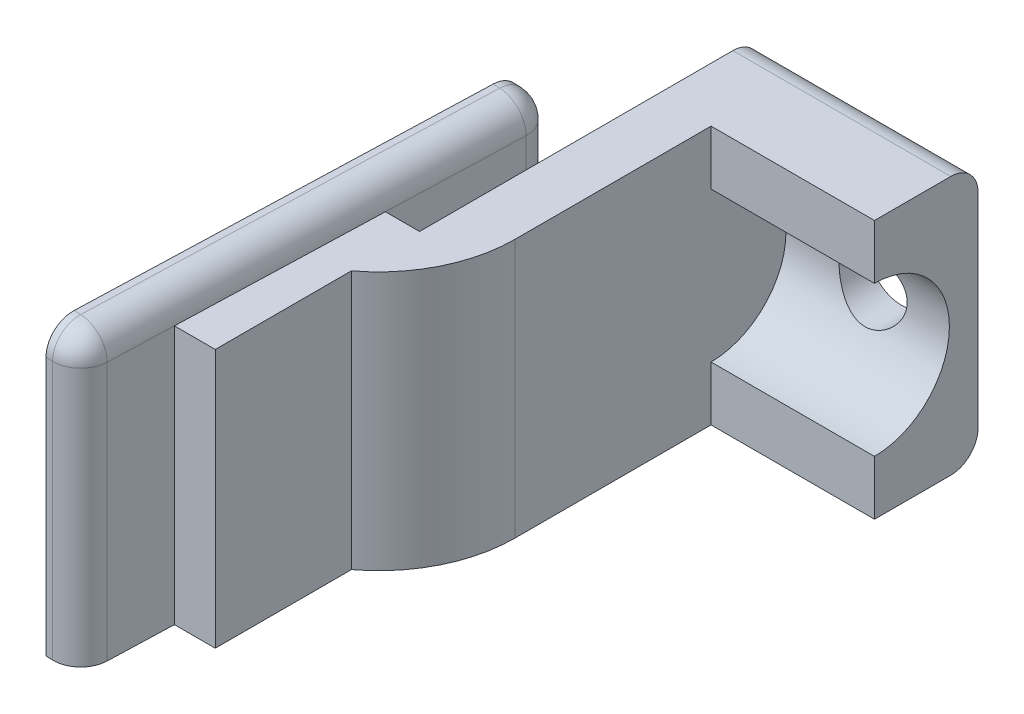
SolidWorks part; units mm, degrees
ref_plane "Front" through (0, 0, 0) normal (0, 0, 1) x (1, 0, 0)
ref_plane "Top" through (0, 0, 0) normal (0, 1, 0) x (1, 0, 0)
ref_plane "Right" through (0, 0, 0) normal (1, 0, 0) x (0, 0, -1)
sketch "Sketch1" plane through (0, 0, 0) normal (0, 1, 0) x (1, 0, 0)
  line L0 (3, 40) -> (3, 15)
  line L1 (0, 0) -> (3, 0)
  line L2 (0, 0) -> (0, 15)
  line L3 (3, 40) -> (7, 40)
  line L4 (7, 10) -> (7, 40)
  line L5 (3, 15) -> (0, 15)
  line L6 (7, 40) -> (0, 40) construction
  line L7 (0, 40) -> (0, 15) construction
  line L8 (3, 10) -> (3, 0)
  line L9 (3, 10) -> (7, 10)
  dimension "D1" = 40
  dimension "D2" = 7
  dimension "D3" = 4
  dimension "D4" = 25
  dimension "D5" = 10
extrude "Boss-Extrude2" add sketch "Sketch1" along normal blind 19
fillet "Fillet1" radius 10 1 edges at (7, 9.5, -10)
sketch "Sketch2" plane through (7, 0, 0) normal (1, 0, 0) x (0, 0, -1)
  line L0 (18, 19) -> (40, 19) construction
  line L1 (40, 0) -> (32.4, 0)
  line L2 (40, 0) -> (40, 19)
  line L3 (40, 19) -> (32.4, 19)
  line L4 (32.4, 0) -> (32.4, 19)
  dimension "D1" = 7.6
extrude "Boss-Extrude3" add sketch "Sketch2" along normal blind 12
sketch "Sketch3" plane through (19, 0, 0) normal (1, 0, 0) x (0, 0, -1)
  line L0 (32.4, 19) -> (32.4, 0) construction
  circle A0 centre (32.4, 9.5) radius 5.5
  dimension "D1" = 11
extrude "Cut-Extrude1" cut sketch "Sketch3" against normal up to surface (12 mm away)
sketch "Sketch4" plane through (0, 0, -40) normal (0, 0, -1) x (-1, 0, 0)
  line L0 (-19, 0) -> (-19, 19) construction
  line L1 (-11, 19) -> (-11, 0) construction
  line L2 (-19, 19) -> (-3, 19) construction
  line L3 (-19, 0) -> (-3, 0) construction
  circle A0 centre (-13.4, 9.5) radius 2.5
  point P10 (0, 0)
  point P11 (-11, 9.5)
  dimension "D1" = 5
  dimension "D2" = 5.6
extrude "Cut-Extrude2" cut sketch "Sketch4" against normal through all both and the other way through all
fillet "Fillet2" radius 2 2 edges at (11, 19, -40) (11, 0, -40)
sketch "Sketch7" plane through (0, 19, 0) normal (0, 1, 0) x (1, 0, 0)
  line L0 (0, 0) -> (0.4942, 15)
  line L1 (3, 15) -> (0, 15) construction
  line L2 (0.4942, 15) -> (0, 15)
  line L3 (0, 15) -> (0, 0)
extrude "Cut-Extrude4" cut sketch "Sketch7" against normal through all both and the other way through all
sketch "Sketch5" plane through (0, 0, 0) normal (-0.9995, 0, -0.0329) x (-0.0329, 0, 0.9995)
  line L6 (-15.0081, 0) -> (-27.0081, 0)
  line L7 (-38.0782, 0) -> (-15.0907, 0) construction
  line L8 (-27.0081, 0) -> (-27.0081, 21)
  line L9 (-27.0081, 21) -> (6.7919, 21)
  line L10 (6.7919, 21) -> (6.7919, 0)
  line L11 (6.7919, 0) -> (-15.0081, 0)
  line L12 (0, 19) -> (-15.0081, 19) construction
  dimension "D1" = 33.8
  dimension "D2" = 12
  dimension "D3" = 2
extrude "Boss-Extrude4" add sketch "Sketch5" along normal blind 2.5
sketch "Sketch6" plane through (-2.4986, 0, -0.0823) normal (-0.9995, 0, -0.0329) x (-0.0329, 0, 0.9995)
  line L0 (6.7919, 10.5) -> (-27.0081, 10.5) construction
  line L3 (6.7919, 0) -> (6.7919, 21) construction
  line L4 (-27.0081, 21) -> (-27.0081, 0) construction
  circle A0 centre (-10.1081, 10.5) radius 5
  point P8 (-10.1081, 10.5)
  dimension "D1" = 10
extrude "Cut-Extrude3" cut sketch "Sketch6" against normal blind 2.5
fillet "Fillet4" radius 2 2 edges at (-1.473, 21, 6.747) (-0.36, 21, -27.0347)
fillet "Fillet5" radius 2 5 edges at (-0.2236, 9.5, 6.7882) (-0.2044, 20.4142, 6.2027) (0.3328, 21, -10.1027) (0.8701, 20.4142, -26.408) (0.8893, 9.5, -26.9935)
